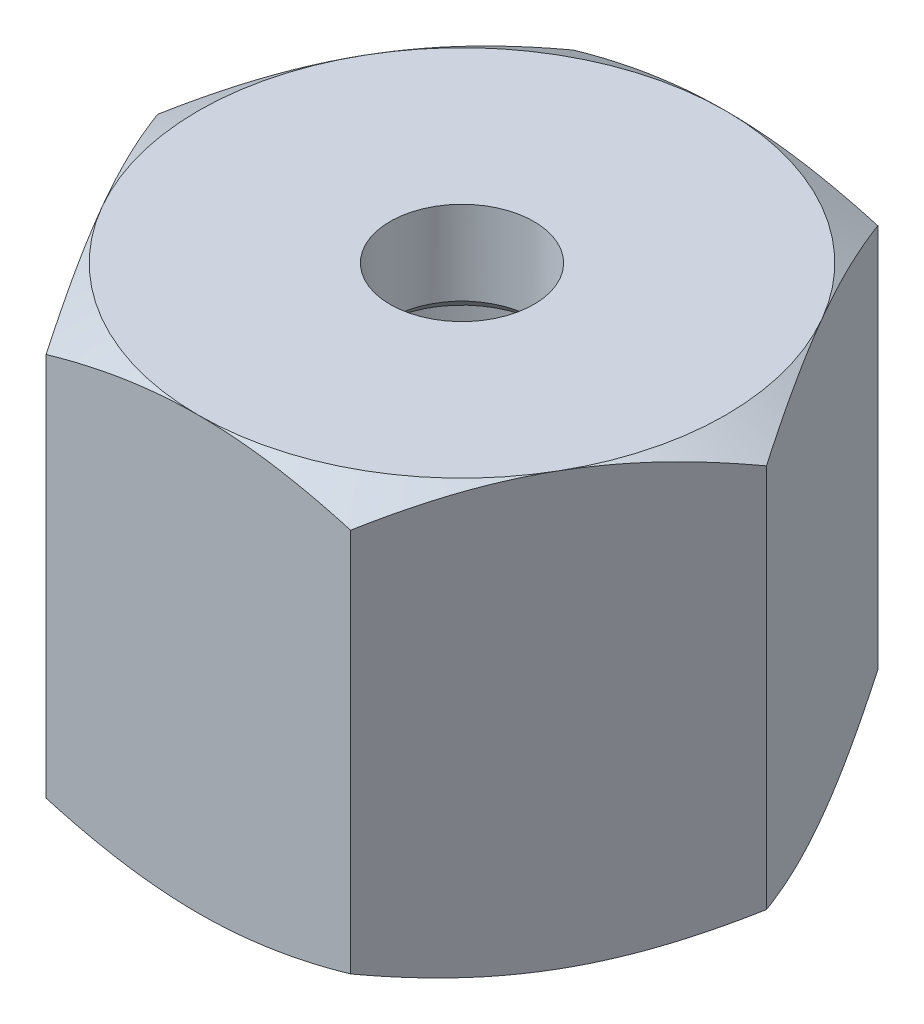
SolidWorks part; units mm, degrees
ref_plane "Přední rovina" through (0, 0, 0) normal (0, 0, 1) x (1, 0, 0)
ref_plane "Horní rovina" through (0, 0, 0) normal (0, 1, 0) x (1, 0, 0)
ref_plane "Pravá rovina" through (0, 0, 0) normal (1, 0, 0) x (0, 0, -1)
sketch "Skica1" plane through (0, 0, 0) normal (0, 1, 0) x (1, 0, 0)
  line L1 (12.7017, 0) -> (6.3509, 11)
  line L2 (6.3509, 11) -> (-6.3509, 11)
  line L3 (-6.3509, 11) -> (-12.7017, 0)
  line L4 (-12.7017, 0) -> (-6.3509, -11)
  line L5 (-6.3509, -11) -> (6.3509, -11)
  line L6 (6.3509, -11) -> (12.7017, 0)
  circle A0 centre (0, 0) radius 11 construction
extrude "Přidat vysunutím1" add sketch "Skica1" along normal blind 18
sketch "Skica2" plane through (0, 18, 0) normal (0, 1, 0) x (1, 0, 0)
  circle A0 centre (0, 0) radius 11
extrude "Odebrat vysunutím1" cut sketch "Skica2" against normal blind 1 draft 60 flip side to cut
sketch "Skica3" plane through (0, 0, 0) normal (0, -1, 0) x (1, 0, 0)
  circle A0 centre (0, 0) radius 11
extrude "Odebrat vysunutím2" cut sketch "Skica3" against normal blind 1 draft 60 flip side to cut
sketch "Skica4" plane through (0, 0, 0) normal (0, -1, 0) x (1, 0, 0)
  circle A0 centre (0, 0) radius 7.75
extrude "Odebrat vysunutím3" cut sketch "Skica4" against normal blind 14
chamfer "Zkosení2" distance 0.35 angle 45 1 edges at (0, 0, -7.75)
sketch "Skica5" plane through (0, 18, 0) normal (0, 1, 0) x (1, 0, 0)
  circle A0 centre (0, 0) radius 3
extrude "Odebrat vysunutím4" cut sketch "Skica5" against normal up to next
chamfer "Zkosení3" distance 0.5 angle 45 1 edges at (0, 14, -3)
